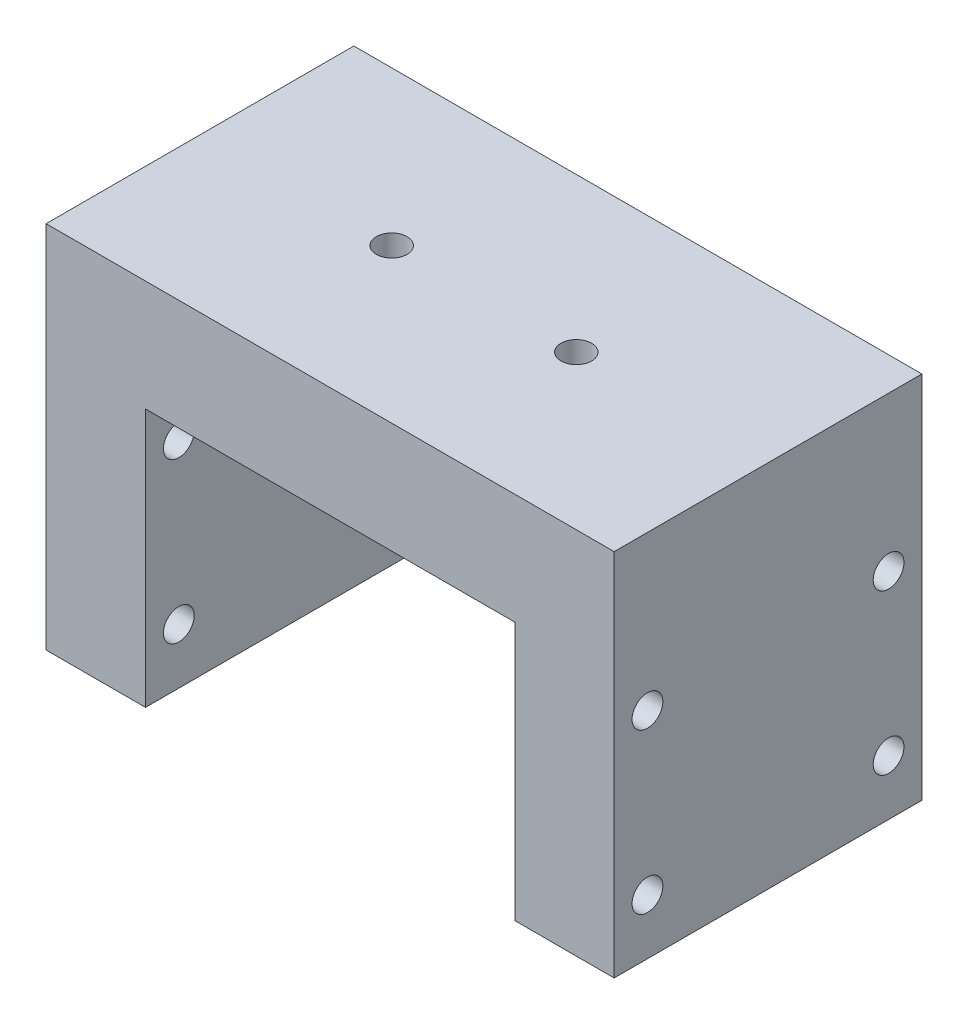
SolidWorks part; units mm, degrees
ref_plane "Front Plane" through (0, 0, 0) normal (0, 0, 1) x (1, 0, 0)
ref_plane "Top Plane" through (0, 0, 0) normal (0, 1, 0) x (1, 0, 0)
ref_plane "Right Plane" through (0, 0, 0) normal (1, 0, 0) x (0, 0, -1)
sketch "Sketch2" plane through (0, 0, 0) normal (0, 0, 1) x (1, 0, 0)
  line L0 (-23.075, -21) -> (-23.075, 9)
  line L1 (-23.075, 9) -> (23.075, 9)
  line L2 (23.075, 9) -> (23.075, -21)
  line L3 (23.075, -21) -> (15, -21)
  line L4 (15, -21) -> (15, 0)
  line L5 (15, 0) -> (-15, 0)
  line L6 (-15, 0) -> (-15, -21)
  line L7 (-15, -21) -> (-23.075, -21)
  point P2 (0, 0)
  point P9 (0, 0)
  dimension "D1" = 30
  dimension "D2" = 21
  dimension "D3" = 46.15
  dimension "D4" = 30
extrude "Boss-Extrude1" add sketch "Sketch2" along normal mid plane 25
hole_wizard "M3x0.5 Tapped Hole1" positions "Sketch3" profile "Sketch4" tap size "M3x0.5" standard "ANSI Metric"
sketch "Sketch3" plane through (0, 9, 0) normal (0, 1, 0) x (1, 0, 0)
  line L0 (-7.5, 0) -> (7.5, 0) construction
  point P0 (-7.5, 0)
  point P2 (7.5, 0)
  point P9 (0, 0)
  dimension "D1" = 15
sketch "Sketch4" plane through (-7.5, 9, 0) normal (1, 0, 0) x (0, 0, 1)
  line L0 (0, 0) -> (0, 10.7511)
  line L1 (0, 10.7511) -> (1.25, 10)
  line L2 (1.25, 10) -> (1.25, 0)
  line L5 (1.25, 0) -> (0, 0)
  line L10 (0, 10.7511) -> (-1.25, 10) construction
  line L11 (0, -6.35) -> (0, 107.95) construction
  dimension "Tap Drill Dia." = 2.5
  dimension "Tap Drill Depth" = 10
  dimension "Drill Angle" = 118
hole_wizard "Ø2.5mm Dowel Hole1" positions "Sketch6" profile "Sketch7" hole size "Ø2.5" standard "ANSI Metric"
sketch "Sketch6" plane through (-23.075, 0, 0) normal (-1, 0, 0) x (0, 0, 1)
  line L1 (-9.795, -3.53) -> (9.795, -3.53) construction
  line L2 (-9.795, -3.53) -> (-9.795, -16.5) construction
  line L3 (-9.795, -16.5) -> (9.795, -16.5) construction
  line L4 (9.795, -3.53) -> (9.795, -16.5) construction
  line L5 (12.5, -21) -> (-12.5, -21) construction
  point P0 (-9.795, -3.53)
  point P1 (9.795, -16.5)
  point P4 (-9.795, -16.5)
  point P5 (9.795, -3.53)
  point P32 (0, -3.53)
  dimension "D1" = 4.5
  dimension "D2" = 19.59
  dimension "D3" = 12.97
sketch "Sketch7" plane through (-23.075, -3.53, -9.795) normal (0, 1, 0) x (0, 0, 1)
  line L0 (0, 0) -> (0, 46.15)
  line L1 (0, 46.15) -> (1.25, 46.15)
  line L2 (1.25, 46.15) -> (1.25, 0)
  line L5 (1.25, 0) -> (0, 0)
  line L11 (0, -6.35) -> (0, 107.95) construction
  dimension "Thru Hole Dia." = 2.5
  dimension "Thru Hole Depth" = 46.15
